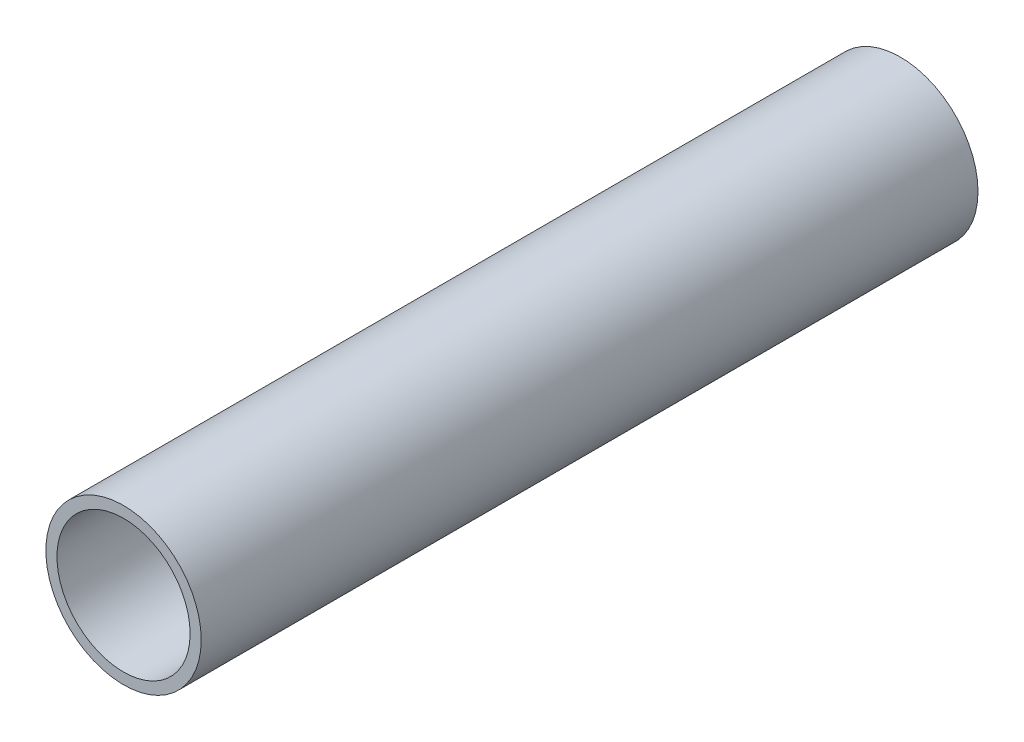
SolidWorks part; units mm, degrees
ref_plane "Face" through (0, 0, 0) normal (0, 0, 1) x (1, 0, 0)
ref_plane "Dessus" through (0, 0, 0) normal (0, 1, 0) x (1, 0, 0)
ref_plane "Droite" through (0, 0, 0) normal (1, 0, 0) x (0, 0, -1)
sketch "Esquisse1" plane through (0, 0, 0) normal (0, 0, 1) x (1, 0, 0)
  circle A0 centre (0, 0) radius 3.5
  circle A1 centre (0, 0) radius 3
  dimension "D1" = 6
  dimension "D2" = 7
extrude "Extrusion1" add sketch "Esquisse1" along normal blind 35
